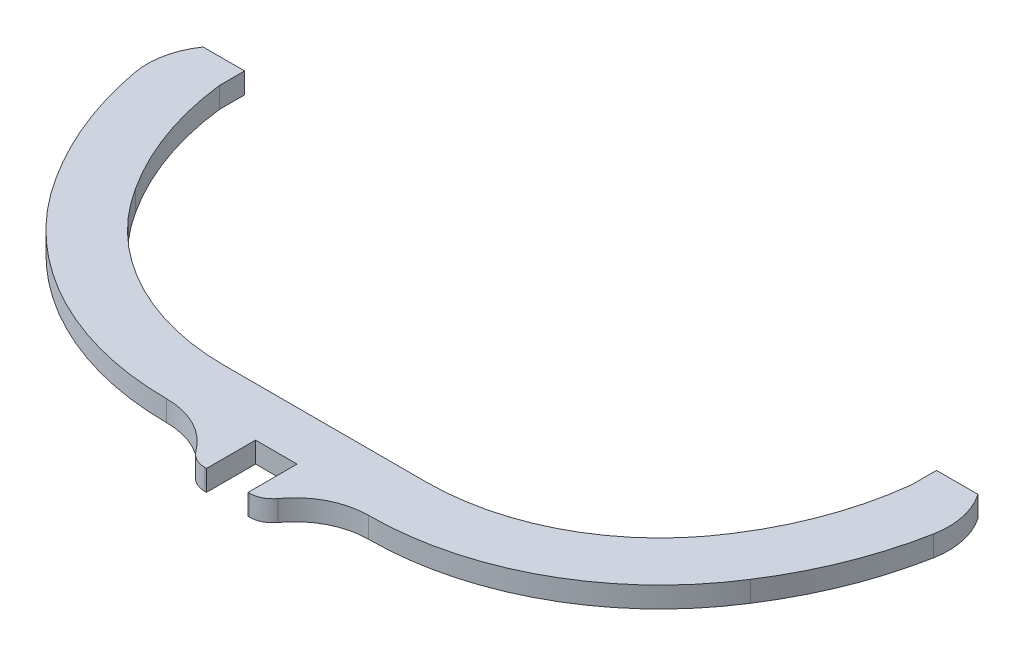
SolidWorks part; units mm, degrees
ref_plane "Спереди" through (0, 0, 0) normal (0, 0, 1) x (1, 0, 0)
ref_plane "Сверху" through (0, 0, 0) normal (0, 1, 0) x (1, 0, 0)
ref_plane "Справа" through (0, 0, 0) normal (1, 0, 0) x (0, 0, -1)
sketch "Эскиз1" plane through (0, 0, 0) normal (0, 1, 0) x (1, 0, 0)
  line L0 (-300, 0) -> (-300, -594.4049) construction
  line L1 (0, 0) -> (-300, 0) construction
  line L2 (0, -535) -> (0, -220) construction
  line L4 (0, -220) -> (-551.6382, -220) construction
  line L5 (87.5793, -450) -> (-87.5793, -450)
  line L7 (-300, -220) -> (-300, -241.8808)
  line L8 (-300, -220) -> (-336, -220)
  line L9 (19.3609, -535) -> (18, -535)
  line L10 (300, -220) -> (300, -241.8808)
  line L11 (300, -220) -> (336, -220)
  line L12 (-18, -535) -> (-18, -492.5)
  line L13 (-18, -492.5) -> (18, -492.5)
  line L14 (18, -492.5) -> (18, -535)
  line L15 (-18, -535) -> (-19.3609, -535)
  arc A0 (-300, -241.8808) -> (-259.0513, -355.5196) centre (-35.9136, -210.9168) ccw
  arc A1 (-259.0513, -355.5196) -> (-87.5793, -450) centre (-87.5793, -247.158) ccw
  arc A2 (-346.4425, -268.8974) -> (-301.1642, -382.4746) centre (-35.9136, -210.9168) ccw
  arc A3 (-301.1642, -382.4746) -> (-87.5793, -500) centre (-87.5793, -247.158) ccw
  arc A4 (-87.5793, -500) -> (-35.6068, -526.6649) centre (-87.5793, -563.9822) cw
  arc A5 (-19.3609, -535) -> (-35.6068, -526.6649) centre (-19.3609, -515) cw
  arc A6 (-346.4425, -268.8974) -> (-336, -220) centre (-282.5771, -256.9727) cw
  arc A7 (19.3609, -535) -> (35.6068, -526.6649) centre (19.3609, -515) ccw
  arc A8 (87.5793, -500) -> (35.6068, -526.6649) centre (87.5793, -563.9822) ccw
  arc A9 (301.1642, -382.4746) -> (87.5793, -500) centre (87.5793, -247.158) cw
  arc A10 (346.4425, -268.8974) -> (301.1642, -382.4746) centre (35.9136, -210.9168) cw
  arc A11 (259.0513, -355.5196) -> (87.5793, -450) centre (87.5793, -247.158) cw
  arc A12 (300, -241.8808) -> (259.0513, -355.5196) centre (35.9136, -210.9168) cw
  arc A13 (346.4425, -268.8974) -> (336, -220) centre (282.5771, -256.9727) ccw
  point P31 (-30.5376, -535)
  point P40 (0, -450)
  dimension "D4" = 21.8808
  dimension "D7" = 20
  dimension "D1" = 300
  dimension "D2" = 315
  dimension "D3" = 36
  dimension "D6" = 30.5376
extrude "Бобышка-Вытянуть1" add sketch "Эскиз1" along normal mid plane 18
